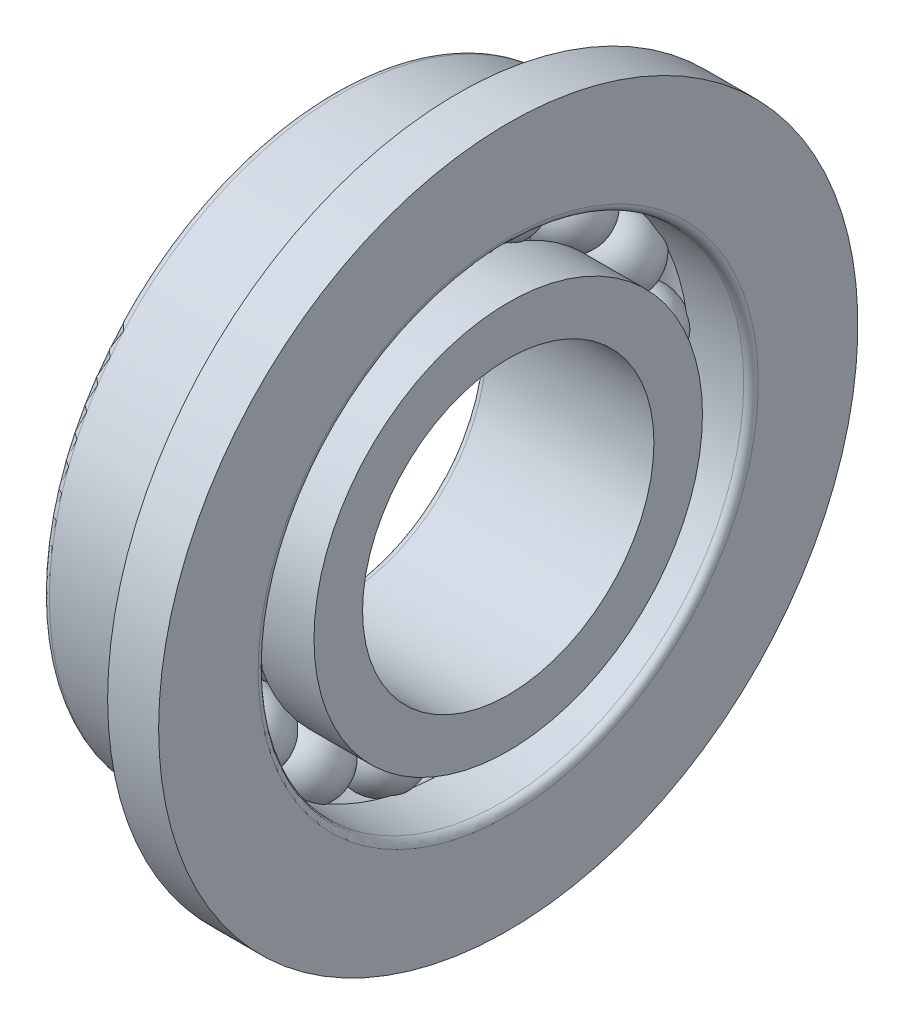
SolidWorks part; units mm, degrees
ref_plane "Front" through (0, 0, 0) normal (0, 0, 1) x (1, 0, 0)
ref_plane "Top" through (0, 0, 0) normal (0, 1, 0) x (1, 0, 0)
ref_plane "Right" through (0, 0, 0) normal (1, 0, 0) x (0, 0, -1)
sketch "Sketch1" plane through (0, 0, 0) normal (0, 0, 1) x (1, 0, 0)
  line L0 (-0.8071, 0) -> (0.9386, 0) construction
  line L1 (-0.8071, 1.5) -> (0.9386, 1.5) construction
  line L2 (-0.25, 1.5) -> (0.25, 1.5)
  arc A0 (-0.25, 1.5) -> (0.25, 1.5) centre (0, 1.5) ccw
  dimension "D2" = 0.5
  dimension "D1" = 1.5
revolve "Revolve1" add sketch "Sketch1" angle 360 about L1
sketch "Sketch2" plane through (0, 0, 0) normal (0, 0, 1) x (1, 0, 0)
  line L0 (-0.6, 1.3333) -> (-0.1727, 1.3333)
  line L1 (0.6, 1.3333) -> (0.6, 1)
  line L2 (0.6, 1) -> (-0.6, 1)
  line L3 (-0.6, 1) -> (-0.6, 1.3333)
  line L4 (-0.8417, 0) -> (1.1297, 0) construction
  line L5 (-0.8417, 1.5) -> (0.9121, 1.5) construction
  line L6 (0.1727, 1.3333) -> (0.6, 1.3333)
  arc A0 (-0.1727, 1.3333) -> (0.1727, 1.3333) centre (0, 1.5) ccw
  dimension "D6" = 0.48
  dimension "D1" = 2
  dimension "D2" = 1.5
  dimension "D3" = 1.2
  dimension "D4" = 0.6
  dimension "D5" = 2.6667
revolve "Revolve2" add sketch "Sketch2" angle 360 about L4
sketch "Sketch3" plane through (0, 0, 0) normal (0, 0, 1) x (1, 0, 0)
  line L0 (-0.6, 2) -> (-0.6, 1.6667)
  line L1 (-0.6, 1.6667) -> (-0.1727, 1.6667)
  line L2 (0.6, 1.6667) -> (0.6, 2.4)
  line L3 (0.6, 2.4) -> (0.25, 2.4)
  line L4 (0.25, 2.4) -> (0.25, 2.02)
  line L5 (0.23, 2) -> (-0.6, 2)
  line L6 (-0.9997, 0) -> (1.1297, 0) construction
  line L8 (-0.9997, 1.5) -> (0.9355, 1.5) construction
  line L9 (0.1727, 1.6667) -> (0.6, 1.6667)
  arc A0 (0.1727, 1.6667) -> (-0.1727, 1.6667) centre (0, 1.5) ccw
  arc A1 (0.23, 2) -> (0.25, 2.02) centre (0.25, 2) ccw
  dimension "D8" = 0.48
  dimension "D1" = 0.04
  dimension "R" = 1.5
  dimension "DD" = 4
  dimension "DD1" = 4.8
  dimension "C1" = 0.35
  dimension "B" = 1.2
  dimension "D6" = 0.6
  dimension "D7" = 3.3333
revolve "Revolve3" add sketch "Sketch3" angle 360 about L6
pattern_circular "Circular-Pattern1" count 17 over 360 about axis through (0, 0, 0) along (1, 0, 0) of "Revolve1"
fillet "Fillet1" radius 0.05 3 edges at (0.6, 0, 1.6667) (-0.6, 0, 2) (-0.6, 0, 1)
equation "\"D1@Sketch1\" = ( \"DD@Sketch3\" + \"D1@Sketch2\" )  / 4"
equation "\"D2@Sketch1\" =  ( \"DD@Sketch3\" - \"D1@Sketch2\" )  / 4"
equation "\"D4@Sketch2\" = \"D3@Sketch2\" / 2"
equation "\"D5@Sketch2\" = \"D1@Sketch2\" +  ( \"DD@Sketch3\" - \"D1@Sketch2\" )  / 3"
equation "\"D2@Sketch2\" = ( \"DD@Sketch3\" + \"D1@Sketch2\" )  / 4"
equation "\"D6@Sketch2\" =  ( \"DD@Sketch3\" - \"D1@Sketch2\" )  / 4 - 0.02"
equation "\"B@Sketch3\" = \"D3@Sketch2\""
equation "\"D6@Sketch3\" = \"B@Sketch3\" / 2"
equation "\"R@Sketch3\" = ( \"DD@Sketch3\" + \"D1@Sketch2\" )  / 4"
equation "\"D7@Sketch3\" = \"DD@Sketch3\" -  ( \"DD@Sketch3\"  - \"D1@Sketch2\") / 3 "
equation "\"D8@Sketch3\" = ( \"DD@Sketch3\" - \"D1@Sketch2\" )  / 4 - 0.02"
equation "\"m@Circular-Pattern1\" = int( 3.14159265 / atn((\"D2@Sketch1\"/2) / sqr(( \"DD@Sketch3\" + \"D1@Sketch2\" )  / 4 * ( \"DD@Sketch3\" + \"D1@Sketch2\" )  / 4 - (\"D2@Sketch1\"/2) *  (\"D2@Sketch1\"/2))))-1"
equation "\"D1@Sketch3\" =  ( \"DD1@Sketch3\" - \"DD@Sketch3\" )  / 20"
